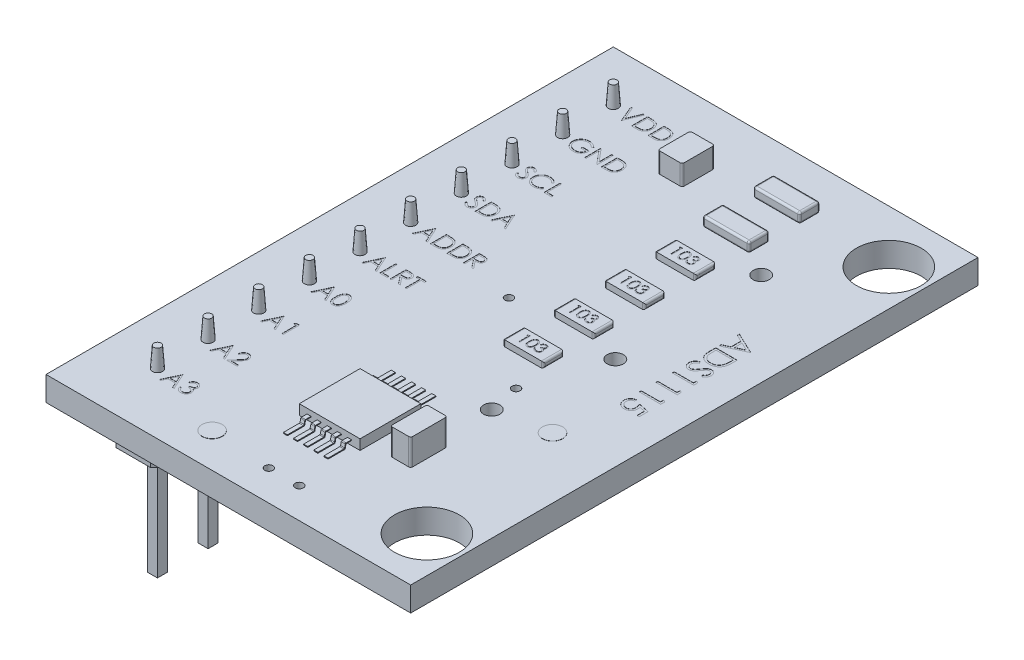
SolidWorks part; units mm, degrees
ref_plane "Alzado" through (0, 0, 0) normal (0, 0, 1) x (1, 0, 0)
ref_plane "Planta" through (0, 0, 0) normal (0, 1, 0) x (1, 0, 0)
ref_plane "Vista lateral" through (0, 0, 0) normal (1, 0, 0) x (0, 0, -1)
sketch "Croquis1" plane through (0, 0, 0) normal (0, 1, 0) x (1, 0, 0)
  line L0 (0, 0) -> (5.6818, 0) construction
  line L1 (-9, 14) -> (9, 14)
  line L2 (-9, 14) -> (-9, -14)
  line L3 (-9, -14) -> (9, -14)
  line L4 (9, 14) -> (9, -14)
  line L5 (-9, 14) -> (9, -14) construction
  line L6 (-9, -14) -> (9, 14) construction
  circle A0 centre (7.2, -11.4) radius 1.6
  circle A2 centre (7.2, 11.4) radius 1.6
  circle A3 centre (0.5, -12.5) radius 0.2
  circle A4 centre (2, -12.5) radius 0.2017
  circle A5 centre (4.4, 7.9) radius 0.4
  circle A6 centre (4.4, 0.7) radius 0.4
  circle A7 centre (3.5, -4.5) radius 0.4
  circle A8 centre (3.2, -3) radius 0.2
  circle A9 centre (-0.85, 0.7) radius 0.2
  point P0 (0, 0)
  point P26 (0, 0)
  dimension "D3" = 3.2
  dimension "D6" = 0.4034
  dimension "D7" = 0.4
  dimension "D11" = 0.8
  dimension "D14" = 0.8
  dimension "D16" = 0.8
  dimension "D19" = 0.4
  dimension "D23" = 0.4
  dimension "D1" = 18
  dimension "D2" = 28
  dimension "D4" = 1.8
  dimension "D5" = 2.6
  dimension "D8" = 1.5
  dimension "D9" = 1.5
  dimension "D10" = 7
  dimension "D12" = 4.6
  dimension "D13" = 6.1
  dimension "D15" = 7.2
  dimension "D17" = 5.5
  dimension "D18" = 9.5
  dimension "D20" = 5.8
  dimension "D21" = 11
  dimension "D22" = 5.25
extrude "Saliente-Extruir1" add sketch "Croquis1" along normal blind 1.2
sketch "Croquis2" plane through (0, 1.2, 0) normal (0, 1, 0) x (1, 0, 0)
  line L0 (9, 14) -> (-9, 14) construction
  line L1 (-9, 14) -> (-9, -14) construction
  circle A0 centre (-6.5, 11.5) radius 0.25
  circle A1 centre (-6.5, 9) radius 0.25
  circle A2 centre (-6.5, 6.5) radius 0.25
  circle A3 centre (-6.5, 4) radius 0.25
  circle A4 centre (-6.5, 1.5) radius 0.25
  circle A5 centre (-6.5, -1) radius 0.25
  circle A6 centre (-6.5, -3.5) radius 0.25
  circle A7 centre (-6.5, -6) radius 0.25
  circle A8 centre (-6.5, -8.5) radius 0.25
  circle A9 centre (-6.5, -11) radius 0.25
  dimension "D1" = 0.5
  dimension "D2" = 2.5
  dimension "D3" = 2.5
  dimension "D4" = 10
extrude "Saliente-Extruir2" add sketch "Croquis2" along normal blind 1 draft 4
sketch "Croquis3" plane through (0, 1.2, 0) normal (0, 1, 0) x (1, 0, 0)
  line L0 (9, -14) -> (9, 14) construction
  line L1 (-9, -14) -> (9, -14) construction
  circle A0 centre (6, -4) radius 0.5
  circle A1 centre (-2.5, -12.3) radius 0.5
  dimension "D1" = 1
  dimension "D6" = 1
  dimension "D2" = 3
  dimension "D3" = 10
  dimension "D4" = 11.5
  dimension "D5" = 1.7
extrude "Saliente-Extruir3" add sketch "Croquis3" along normal blind 0.01 separate body
sketch "Croquis4" plane through (0, 1.2, 0) normal (0, 1, 0) x (1, 0, 0)
  line L0 (9, 14) -> (-9, 14) construction
  line L1 (-2.5, 11.3) -> (-1.3, 11.3)
  line L2 (-2.5, 11.3) -> (-2.5, 9.7)
  line L3 (-2.5, 9.7) -> (-1.3, 9.7)
  line L4 (-1.3, 11.3) -> (-1.3, 9.7)
  line L5 (-2.5, 11.3) -> (-1.3, 9.7) construction
  line L6 (-2.5, 9.7) -> (-1.3, 11.3) construction
  line L7 (-9, 14) -> (-9, -14) construction
  point P0 (-1.9, 10.5)
  dimension "D1" = 1.2
  dimension "D2" = 2.7
  dimension "D3" = 6.5
  dimension "D4" = 1.6
extrude "Saliente-Extruir4" add sketch "Croquis4" along normal blind 1 separate body
sketch "Croquis5" plane through (0, 1.2, 0) normal (0, 1, 0) x (1, 0, 0)
  line L0 (9, 14) -> (-9, 14) construction
  line L1 (0.9, 12) -> (3.2, 12)
  line L2 (0.9, 12) -> (0.9, 11)
  line L3 (0.9, 11) -> (3.2, 11)
  line L4 (3.2, 12) -> (3.2, 11)
  line L5 (0.9, 12) -> (3.2, 11) construction
  line L6 (0.9, 11) -> (3.2, 12) construction
  line L7 (9, -14) -> (9, 14) construction
  line L14 (0.9, 9.5) -> (0.9, 8.5)
  line L15 (0.9, 9.5) -> (3.2, 9.5)
  line L16 (3.2, 9.5) -> (3.2, 8.5)
  line L17 (0.9, 8.5) -> (3.2, 8.5)
  point P0 (2.05, 11.5)
  dimension "D1" = 2.3
  dimension "D2" = 1
  dimension "D3" = 2
  dimension "D4" = 5.8
  dimension "D5" = 2
extrude "Saliente-Extruir5" add sketch "Croquis5" along normal blind 0.5 separate body
sketch "Croquis6" plane through (0, 1.2, 0) normal (0, 1, 0) x (1, 0, 0)
  line L0 (-6.25, 6.5) -> (3.4969, 6.5) construction
  line L2 (2.05, 8.5) -> (2.05, 6.5) construction
  line L3 (1.05, 7) -> (3.05, 7)
  line L4 (1.05, 7) -> (1.05, 6)
  line L5 (1.05, 6) -> (3.05, 6)
  line L6 (3.05, 7) -> (3.05, 6)
  line L7 (1.05, 7) -> (3.05, 6) construction
  line L8 (1.05, 6) -> (3.05, 7) construction
  line L9 (0.9, 8.5) -> (3.2, 8.5) construction
  line L10 (1.05, 4.5) -> (1.05, 3.5)
  line L11 (1.05, 4.5) -> (3.05, 4.5)
  line L12 (3.05, 4.5) -> (3.05, 3.5)
  line L13 (1.05, 3.5) -> (3.05, 3.5)
  line L14 (1.05, 2) -> (1.05, 1)
  line L15 (1.05, 2) -> (3.05, 2)
  line L16 (3.05, 2) -> (3.05, 1)
  line L17 (1.05, 1) -> (3.05, 1)
  line L18 (1.05, -0.5) -> (1.05, -1.5)
  line L19 (1.05, -0.5) -> (3.05, -0.5)
  line L20 (3.05, -0.5) -> (3.05, -1.5)
  line L21 (1.05, -1.5) -> (3.05, -1.5)
  circle A0 centre (-6.5, 6.5) radius 0.25 construction
  point P10 (2.05, 6.5)
  dimension "D1" = 2
  dimension "D2" = 1
  dimension "D3" = 4
extrude "Saliente-Extruir6" add sketch "Croquis6" along normal blind 0.3 separate body
sketch "Croquis7" plane through (0, 1.2, 0) normal (0, 1, 0) x (1, 0, 0)
  line L0 (9, -14) -> (9, 14) construction
  line L1 (3, -7.2) -> (4, -7.2)
  line L2 (3, -7.2) -> (3, -9)
  line L3 (3, -9) -> (4, -9)
  line L4 (4, -7.2) -> (4, -9)
  line L5 (3, -7.2) -> (4, -9) construction
  line L6 (3, -9) -> (4, -7.2) construction
  line L7 (-9, -14) -> (9, -14) construction
  point P0 (3.5, -8.1)
  dimension "D1" = 5
  dimension "D2" = 5
  dimension "D3" = 1
  dimension "D4" = 1.8
extrude "Saliente-Extruir7" add sketch "Croquis7" along normal blind 1.3 separate body
sketch "Croquis9" plane through (0, 1.2, 0) normal (0, 1, 0) x (1, 0, 0)
  line L0 (9, -14) -> (9, 14) construction
  line L1 (-1, -6.5) -> (2, -6.5)
  line L2 (-1, -6.5) -> (-1, -9.5)
  line L3 (-1, -9.5) -> (2, -9.5)
  line L4 (2, -6.5) -> (2, -9.5)
  line L5 (-1, -6.5) -> (2, -9.5) construction
  line L6 (-1, -9.5) -> (2, -6.5) construction
  line L7 (-9, -14) -> (9, -14) construction
  point P0 (0.5, -8)
  dimension "D1" = 3
  dimension "D2" = 3
  dimension "D3" = 7
  dimension "D4" = 4.5
extrude "Saliente-Extruir8" add sketch "Croquis9" along normal blind 0.5 separate body
ref_plane "Plano1" through (-0.62, 0, 0) normal (1, 0, 0) x (0, 0, -1)
sketch "Croquis11" plane through (-0.62, 0, 0) normal (1, 0, 0) x (0, 0, -1)
  line L0 (-9.5, 1.45) -> (-9.7684, 1.45)
  line L1 (-9.5, 1.7) -> (-9.5, 1.2) construction
  line L4 (-10.6621, 1.244) -> (-10.6621, 1.2)
  line L5 (14, 1.2) -> (-14, 1.2) construction
  line L6 (-10.6621, 1.2) -> (-9.8497, 1.2)
  line L7 (-9.5, 1.4143) -> (-9.5, 1.45)
  line L8 (-9.5, 1.4143) -> (-9.7357, 1.4143)
  line L10 (-9.8073, 1.4192) -> (-9.8415, 1.2747)
  line L11 (-9.7746, 1.3835) -> (-9.8108, 1.2308)
  line L12 (-9.8804, 1.244) -> (-10.6621, 1.244)
  line L13 (-8, 1.7) -> (-8, 1.2) construction
  line L14 (-6.5, 1.7) -> (-9.5, 1.7) construction
  line L15 (-6.1196, 1.244) -> (-5.3379, 1.244)
  line L16 (-6.1927, 1.4192) -> (-6.1585, 1.2747)
  line L17 (-6.5, 1.45) -> (-6.2316, 1.45)
  line L18 (-6.5, 1.4143) -> (-6.5, 1.45)
  line L19 (-6.5, 1.4143) -> (-6.2643, 1.4143)
  line L20 (-6.2254, 1.3835) -> (-6.1892, 1.2308)
  line L21 (-5.3379, 1.2) -> (-6.1503, 1.2)
  line L22 (-5.3379, 1.244) -> (-5.3379, 1.2)
  arc A0 (-9.8108, 1.2308) -> (-9.8497, 1.2) centre (-9.8497, 1.24) cw
  arc A1 (-9.8415, 1.2747) -> (-9.8804, 1.244) centre (-9.8804, 1.284) cw
  arc A2 (-9.7684, 1.45) -> (-9.8073, 1.4192) centre (-9.7684, 1.41) ccw
  arc A3 (-9.7746, 1.3835) -> (-9.7357, 1.4143) centre (-9.7357, 1.3743) cw
  arc A4 (-6.1585, 1.2747) -> (-6.1196, 1.244) centre (-6.1196, 1.284) ccw
  arc A5 (-6.2316, 1.45) -> (-6.1927, 1.4192) centre (-6.2316, 1.41) cw
  arc A6 (-6.2254, 1.3835) -> (-6.2643, 1.4143) centre (-6.2643, 1.3743) ccw
  arc A7 (-6.1892, 1.2308) -> (-6.1503, 1.2) centre (-6.1503, 1.24) ccw
  point P5 (-10.5995, 1.244)
  point P19 (-9.8, 1.45)
  dimension "D3" = 0.04
  dimension "D1" = 0.04
  dimension "D2" = 0.3
  dimension "D4" = 0.044
extrude "Saliente-Extruir9" add sketch "Croquis11" along normal blind 0.2
pattern_linear "MatrizL1" count 5 spacing 0.5 along (1, 0, 0) of "Saliente-Extruir9"
sketch "Croquis13" plane through (0, 1.2, 0) normal (0, 1, 0) x (1, 0, 0)
  line L0 (-6.0357, 11.0685) -> (-3.1184, 11.0685) construction
  line L1 (-6.0357, 8.5685) -> (-3.1184, 8.5685) construction
  line L2 (-6.0357, 6.0685) -> (-3.1184, 6.0685) construction
  line L3 (-6.0357, 3.5685) -> (-3.1184, 3.5685) construction
  line L4 (-6.0357, 1.0685) -> (-3.1184, 1.0685) construction
  line L5 (-6.0357, -1.4315) -> (-3.1184, -1.4315) construction
  line L6 (-6.0357, -3.9315) -> (-3.1184, -3.9315) construction
  line L7 (-6.0357, -6.4315) -> (-3.1184, -6.4315) construction
  line L8 (-6.0357, -8.9315) -> (-3.1184, -8.9315) construction
  line L9 (-6.0357, -11.4315) -> (-3.1184, -11.4315) construction
  line L10 (6.3878, 4.8893) -> (6.3878, -1.7301) construction
  text T0 "VDD" font "Century Gothic" height in points 3
  text T1 "GND" font "Century Gothic" height in points 3
  text T2 "SCL" font "Century Gothic" height in points 3
  text T3 "SDA" font "Century Gothic" height in points 3
  text T4 "ADDR" font "Century Gothic" height in points 3
  text T5 "ALRT" font "Century Gothic" height in points 3
  text T6 "A0" font "Century Gothic" height in points 3
  text T7 "A1" font "Century Gothic" height in points 3
  text T8 "A2" font "Century Gothic" height in points 3
  text T9 "A3" font "Century Gothic" height in points 3
  text T10 "ADS1115" font "Century Gothic" height in points 4
  dimension "D1" = 10
extrude "Cortar-Extruir1" cut sketch "Croquis13" against normal blind 0.01
sketch "Croquis14" plane through (0, 0, 0) normal (0, -1, 0) x (1, 0, 0)
  line L0 (-7.75, -10.2) -> (-7.75, -7.8)
  line L5 (-7.75, -10.2) -> (-5.25, -10.2)
  line L6 (-5.25, -10.2) -> (-5.25, -7.8)
  line L7 (-7.75, -12.7) -> (-5.25, -12.7)
  line L8 (-7.75, -12.7) -> (-7.75, -10.3)
  line L9 (-7.75, -10.3) -> (-5.25, -10.3)
  line L10 (-5.25, -12.7) -> (-5.25, -10.3)
  line L11 (-7.75, -12.7) -> (-5.25, -10.3) construction
  line L12 (-7.75, -10.3) -> (-5.25, -12.7) construction
  line L13 (-7.75, -7.8) -> (-5.25, -7.8)
  line L14 (-7.75, -7.7) -> (-7.75, -5.3)
  line L15 (-7.75, -7.7) -> (-5.25, -7.7)
  line L16 (-5.25, -7.7) -> (-5.25, -5.3)
  line L17 (-7.75, -5.3) -> (-5.25, -5.3)
  line L18 (-7.75, -5.2) -> (-7.75, -2.8)
  line L19 (-7.75, -5.2) -> (-5.25, -5.2)
  line L20 (-5.25, -5.2) -> (-5.25, -2.8)
  line L21 (-7.75, -2.8) -> (-5.25, -2.8)
  line L22 (-7.75, -2.7) -> (-7.75, -0.3)
  line L23 (-7.75, -2.7) -> (-5.25, -2.7)
  line L24 (-5.25, -2.7) -> (-5.25, -0.3)
  line L25 (-7.75, -0.3) -> (-5.25, -0.3)
  line L26 (-7.75, -0.2) -> (-7.75, 2.2)
  line L27 (-7.75, -0.2) -> (-5.25, -0.2)
  line L28 (-5.25, -0.2) -> (-5.25, 2.2)
  line L29 (-7.75, 2.2) -> (-5.25, 2.2)
  line L30 (-7.75, 2.3) -> (-7.75, 4.7)
  line L31 (-7.75, 2.3) -> (-5.25, 2.3)
  line L32 (-5.25, 2.3) -> (-5.25, 4.7)
  line L33 (-7.75, 4.7) -> (-5.25, 4.7)
  line L34 (-7.75, 4.8) -> (-7.75, 7.2)
  line L35 (-7.75, 4.8) -> (-5.25, 4.8)
  line L36 (-5.25, 4.8) -> (-5.25, 7.2)
  line L37 (-7.75, 7.2) -> (-5.25, 7.2)
  line L38 (-7.75, 7.3) -> (-7.75, 9.7)
  line L39 (-7.75, 7.3) -> (-5.25, 7.3)
  line L40 (-5.25, 7.3) -> (-5.25, 9.7)
  line L41 (-7.75, 9.7) -> (-5.25, 9.7)
  line L42 (-7.75, 9.8) -> (-7.75, 12.2)
  line L43 (-7.75, 9.8) -> (-5.25, 9.8)
  line L44 (-5.25, 9.8) -> (-5.25, 12.2)
  line L45 (-7.75, 12.2) -> (-5.25, 12.2)
  point P5 (-6.5, -11.5)
  dimension "D1" = 2.5
  dimension "D2" = 2.4
  dimension "D3" = 10
extrude "Saliente-Extruir10" add sketch "Croquis14" along normal blind 2 contours L7 L10 L5 L8 | L13 L0 L5 L6 | L17 L14 L13 L16 | L21 L18 L17 L20 | L25 L22 L21 L24 | L29 L26 L25 L28 | L33 L30 L29 L32 | L37 L34 L33 L36 | L41 L38 L37 L40 | L45 L42 L41 L44
sketch "Croquis15" plane through (0, -2, 0) normal (0, -1, 0) x (1, 0, 0)
  line L7 (-6.75, -11.75) -> (-6.25, -11.75)
  line L8 (-6.75, -11.75) -> (-6.75, -11.25)
  line L9 (-6.75, -11.25) -> (-6.25, -11.25)
  line L10 (-6.25, -11.75) -> (-6.25, -11.25)
  line L11 (-6.75, -11.75) -> (-6.25, -11.25) construction
  line L12 (-6.75, -11.25) -> (-6.25, -11.75) construction
  point P1 (0, 0)
  point P7 (-6.5, -11.5)
  dimension "D1" = 0.5
  dimension "D2" = 0.5
extrude "Saliente-Extruir11" add sketch "Croquis15" along normal blind 5.5
pattern_linear "MatrizL2" count 10 spacing 2.5 along (0, 0, 1) of "Saliente-Extruir11"
chamfer "Chaflán1" distance 0.4 angle 45 4 edges at (-7.75, -1, -10.3) (-5.25, -1, -10.3) (-5.25, -1, -12.7) (-7.75, -1, -12.7)
chamfer "Chaflán2" distance 0.4 angle 45 36 edges at (-5.25, -1, 4.8) (-5.25, -1, 7.3) (-5.25, -1, 9.8) (-5.25, -1, 12.2) (-7.75, -1, 12.2) (-7.75, -1, 9.8) (-7.75, -1, 9.7) (-7.75, -1, 7.3) (-7.75, -1, 7.2) (-7.75, -1, 4.8) (-7.75, -1, 4.7) (-5.25, -1, 2.3) (-5.25, -1, 2.2) (-5.25, -1, -0.2) (-5.25, -1, -0.3) (-7.75, -1, 2.3) (-7.75, -1, 2.2) (-7.75, -1, -0.2) (-7.75, -1, -0.3) (-7.75, -1, -2.7) (-7.75, -1, -2.8) (-5.25, -1, -2.7) (-5.25, -1, -2.8) (-5.25, -1, -5.2) (-5.25, -1, -5.3) (-7.75, -1, -5.3) (-7.75, -1, -7.7) (-5.25, -1, -7.7) (-5.25, -1, -7.8) (-5.25, -1, -10.2) (-7.75, -1, -7.8) (-7.75, -1, -10.2) (-5.25, -1, 4.7) (-7.75, -1, -5.2) (-5.25, -1, 7.2) (-5.25, -1, 9.7)
fillet "Redondeo1" radius 0.1 4 edges at (-2.5, 1.7, -9.7) (-1.3, 1.7, -9.7) (-1.3, 1.7, -11.3) (-2.5, 1.7, -11.3)
fillet "Redondeo2" radius 0.1 4 edges at (4, 1.85, 7.2) (4, 1.85, 9) (3, 1.85, 9) (3, 1.85, 7.2)
fillet "Redondeo3" radius 0.1 12 edges at (0.9, 1.45, -12) (0.9, 1.7, -11.5) (0.9, 1.45, -11) (0.9, 1.2, -11.5) (3.2, 1.45, -11) (3.2, 1.7, -11.5) (3.2, 1.45, -12) (3.2, 1.2, -11.5) (2.05, 1.7, -11) (2.05, 1.2, -11) (2.05, 1.7, -12) (2.05, 1.2, -12)
fillet "Redondeo4" radius 0.1 12 edges at (0.9, 1.7, -9) (0.9, 1.2, -9) (0.9, 1.45, -8.5) (2.05, 1.7, -8.5) (2.05, 1.2, -8.5) (2.05, 1.7, -9.5) (0.9, 1.45, -9.5) (2.05, 1.2, -9.5) (3.2, 1.45, -8.5) (3.2, 1.7, -9) (3.2, 1.45, -9.5) (3.2, 1.2, -9)
fillet "Redondeo5" radius 0.1 8 edges at (1.05, 1.35, -7) (1.05, 1.5, -6.5) (1.05, 1.35, -6) (1.05, 1.2, -6.5) (3.05, 1.35, -6) (3.05, 1.5, -6.5) (3.05, 1.35, -7) (3.05, 1.2, -6.5)
fillet "Redondeo6" radius 0.1 8 edges at (3.05, 1.35, -3.5) (3.05, 1.5, -4) (3.05, 1.35, -4.5) (3.05, 1.2, -4) (1.05, 1.35, -4.5) (1.05, 1.5, -4) (1.05, 1.35, -3.5) (1.05, 1.2, -4)
fillet "Redondeo7" radius 0.1 8 edges at (3.05, 1.35, -1) (3.05, 1.5, -1.5) (3.05, 1.35, -2) (3.05, 1.2, -1.5) (1.05, 1.35, -2) (1.05, 1.5, -1.5) (1.05, 1.35, -1) (1.05, 1.2, -1.5)
fillet "Redondeo8" radius 0.1 8 edges at (3.05, 1.35, 1.5) (3.05, 1.5, 1) (3.05, 1.35, 0.5) (3.05, 1.2, 1) (1.05, 1.35, 0.5) (1.05, 1.5, 1) (1.05, 1.35, 1.5) (1.05, 1.2, 1)
sketch "Croquis16" plane through (0, 1.5, 0) normal (0, 1, 0) x (1, 0, 0)
  line L0 (1.3817, 6.2707) -> (2.7701, 6.2707) construction
  line L1 (1.3817, 3.7707) -> (2.7701, 3.7707) construction
  line L2 (1.3817, 1.2707) -> (2.7701, 1.2707) construction
  line L3 (1.3817, -1.2293) -> (2.7701, -1.2293) construction
  text T0 "103" font "Century Gothic" height in points 2
  text T1 "103" font "Century Gothic" height in points 2
  text T2 "103" font "Century Gothic" height in points 2
  text T3 "103" font "Century Gothic" height in points 2
  dimension "D1" = 4
extrude "Cortar-Extruir2" cut sketch "Croquis16" against normal blind 0.01
